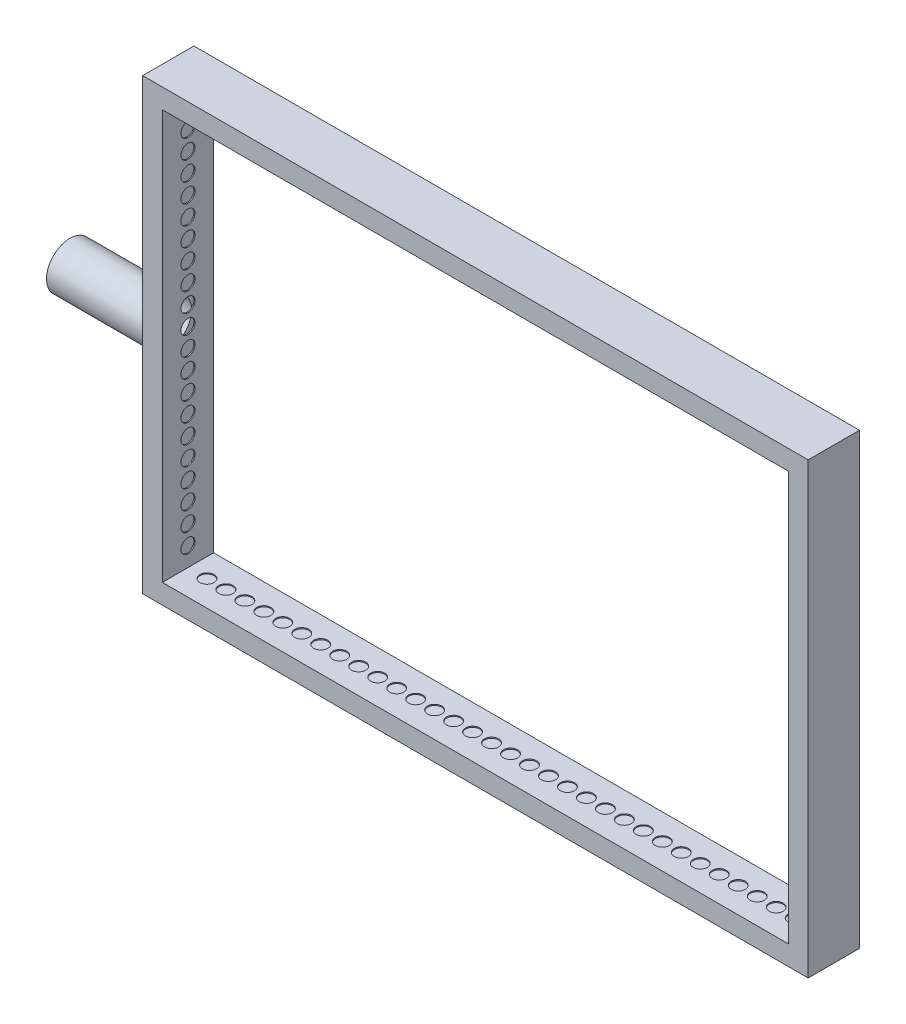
SolidWorks part; units mm, degrees
ref_plane "Alzado" through (0, 0, 0) normal (0, 0, 1) x (1, 0, 0)
ref_plane "Planta" through (0, 0, 0) normal (0, 1, 0) x (1, 0, 0)
ref_plane "Vista lateral" through (0, 0, 0) normal (1, 0, 0) x (0, 0, -1)
sketch "Croquis1" plane through (0, 0, 0) normal (0, 0, 1) x (1, 0, 0)
  line L1 (0, 0) -> (947, 0)
  line L2 (0, 0) -> (0, 638.5)
  line L3 (0, 638.5) -> (947, 638.5)
  line L4 (947, 0) -> (947, 638.5)
  line L10 (28, 610.5) -> (919, 610.5)
  line L11 (28, 610.5) -> (28, 28)
  line L12 (28, 28) -> (919, 28)
  line L13 (919, 610.5) -> (919, 28)
  dimension "D1" = 947
  dimension "D2" = 638.5
  dimension "D3" = 582.5
  dimension "D4" = 891
extrude "Saliente-Extruir1" add sketch "Croquis1" along normal blind 73
ref_plane "Plano1" through (0, 0, 36.5) normal (0, 0, 1) x (1, 0, 0)
sketch "Croquis2" plane through (0, 0, 36.5) normal (0, 0, 1) x (1, 0, 0)
  line L0 (945.5, 1.5) -> (945.5, 637)
  line L4 (920.5, 26.5) -> (26.5, 26.5)
  line L6 (920.5, 26.5) -> (920.5, 612)
  line L7 (1.5, 637) -> (945.5, 637)
  line L8 (1.5, 637) -> (1.5, 1.5)
  line L9 (1.5, 1.5) -> (945.5, 1.5)
  line L12 (920.5, 612) -> (26.5, 612)
  line L14 (26.5, 26.5) -> (26.5, 612)
extrude "Cortar-Extruir2" cut sketch "Croquis2" against normal mid plane 70
sketch "Croquis5" plane through (0, 28, 0) normal (0, 1, 0) x (1, 0, 0)
  line L0 (28, -73) -> (28, 0) construction
  circle A0 centre (55, -36.5) radius 10
  point P0 (28, -36.5)
  dimension "D1" = 27
  dimension "D2" = 20
extrude "Cortar-Extruir4" cut sketch "Croquis5" against normal blind 1.5
sketch "Croquis6" plane through (0, 28, 0) normal (0, 1, 0) x (1, 0, 0)
  circle A0 centre (82, -36.5) radius 10
  circle A1 centre (109, -36.5) radius 10
  circle A2 centre (136, -36.5) radius 10
  circle A3 centre (163, -36.5) radius 10
  circle A4 centre (190, -36.5) radius 10
  circle A5 centre (217, -36.5) radius 10
  circle A6 centre (244, -36.5) radius 10
  circle A7 centre (271, -36.5) radius 10
  circle A8 centre (298, -36.5) radius 10
  circle A9 centre (325, -36.5) radius 10
  circle A10 centre (352, -36.5) radius 10
  circle A11 centre (379, -36.5) radius 10
  circle A12 centre (406, -36.5) radius 10
  circle A13 centre (433, -36.5) radius 10
  circle A14 centre (460, -36.5) radius 10
  circle A15 centre (487, -36.5) radius 10
  circle A16 centre (514, -36.5) radius 10
  circle A17 centre (541, -36.5) radius 10
  circle A18 centre (568, -36.5) radius 10
  circle A19 centre (595, -36.5) radius 10
  circle A20 centre (622, -36.5) radius 10
  circle A21 centre (649, -36.5) radius 10
  circle A22 centre (676, -36.5) radius 10
  circle A23 centre (703, -36.5) radius 10
  circle A24 centre (730, -36.5) radius 10
  circle A25 centre (757, -36.5) radius 10
  circle A26 centre (784, -36.5) radius 10
  circle A27 centre (811, -36.5) radius 10
  circle A28 centre (838, -36.5) radius 10
  circle A29 centre (865, -36.5) radius 10
  circle A30 centre (892, -36.5) radius 10
  dimension "D1" = 31
extrude "Cortar-Extruir5" cut sketch "Croquis6" against normal blind 1.5
sketch "Croquis7" plane through (28, 0, 0) normal (1, 0, 0) x (0, 0, -1)
  line L0 (-73, 28) -> (0, 28) construction
  circle A0 centre (-36.5, 55) radius 10
  point P0 (-36.5, 28)
  dimension "D1" = 27
  dimension "D2" = 20
extrude "Cortar-Extruir6" cut sketch "Croquis7" against normal blind 1.5
sketch "Croquis8" plane through (28, 0, 0) normal (1, 0, 0) x (0, 0, -1)
  circle A0 centre (-36.5, 82) radius 10
  circle A1 centre (-36.5, 109) radius 10
  circle A2 centre (-36.5, 136) radius 10
  circle A3 centre (-36.5, 163) radius 10
  circle A4 centre (-36.5, 190) radius 10
  circle A5 centre (-36.5, 217) radius 10
  circle A6 centre (-36.5, 244) radius 10
  circle A7 centre (-36.5, 271) radius 10
  circle A8 centre (-36.5, 298) radius 10
  circle A9 centre (-36.5, 325) radius 10
  circle A10 centre (-36.5, 352) radius 10
  circle A11 centre (-36.5, 379) radius 10
  circle A12 centre (-36.5, 406) radius 10
  circle A13 centre (-36.5, 433) radius 10
  circle A14 centre (-36.5, 460) radius 10
  circle A15 centre (-36.5, 487) radius 10
  circle A16 centre (-36.5, 514) radius 10
  circle A17 centre (-36.5, 541) radius 10
  circle A18 centre (-36.5, 568) radius 10
  circle A19 centre (-36.5, 595) radius 10
  dimension "D1" = 20
  dimension "D2" = 20
extrude "Cortar-Extruir7" cut sketch "Croquis8" against normal blind 1.5
sketch "Croquis9" plane through (919, 0, 0) normal (-1, 0, 0) x (0, 0, 1)
  circle A0 centre (36.5, 55) radius 10
  circle A1 centre (36.5, 82) radius 10
  circle A2 centre (36.5, 109) radius 10
  circle A3 centre (36.5, 136) radius 10
  circle A4 centre (36.5, 163) radius 10
  circle A5 centre (36.5, 190) radius 10
  circle A6 centre (36.5, 217) radius 10
  circle A7 centre (36.5, 244) radius 10
  circle A8 centre (36.5, 271) radius 10
  circle A9 centre (36.5, 298) radius 10
  circle A10 centre (36.5, 325) radius 10
  circle A11 centre (36.5, 352) radius 10
  circle A12 centre (36.5, 379) radius 10
  circle A13 centre (36.5, 406) radius 10
  circle A14 centre (36.5, 433) radius 10
  circle A15 centre (36.5, 460) radius 10
  circle A16 centre (36.5, 487) radius 10
  circle A17 centre (36.5, 514) radius 10
  circle A18 centre (36.5, 541) radius 10
  circle A19 centre (36.5, 568) radius 10
  circle A20 centre (36.5, 595) radius 10
  dimension "D1" = 21
extrude "Cortar-Extruir8" cut sketch "Croquis9" against normal blind 1.5
sketch "Croquis10" plane through (0, 610.5, 0) normal (0, -1, 0) x (1, 0, 0)
  line L0 (919, 73) -> (919, 0) construction
  circle A0 centre (892, 36.5) radius 10
  circle A1 centre (865, 36.5) radius 10
  circle A2 centre (838, 36.5) radius 10
  circle A3 centre (811, 36.5) radius 10
  circle A4 centre (784, 36.5) radius 10
  circle A5 centre (757, 36.5) radius 10
  circle A6 centre (730, 36.5) radius 10
  circle A7 centre (703, 36.5) radius 10
  circle A8 centre (676, 36.5) radius 10
  circle A9 centre (649, 36.5) radius 10
  circle A10 centre (622, 36.5) radius 10
  circle A11 centre (595, 36.5) radius 10
  circle A12 centre (568, 36.5) radius 10
  circle A13 centre (541, 36.5) radius 10
  circle A14 centre (514, 36.5) radius 10
  circle A15 centre (487, 36.5) radius 10
  circle A16 centre (460, 36.5) radius 10
  circle A17 centre (433, 36.5) radius 10
  circle A18 centre (406, 36.5) radius 10
  circle A19 centre (379, 36.5) radius 10
  circle A20 centre (352, 36.5) radius 10
  circle A21 centre (325, 36.5) radius 10
  circle A22 centre (298, 36.5) radius 10
  circle A23 centre (271, 36.5) radius 10
  circle A24 centre (244, 36.5) radius 10
  circle A25 centre (217, 36.5) radius 10
  circle A26 centre (190, 36.5) radius 10
  circle A27 centre (163, 36.5) radius 10
  circle A28 centre (136, 36.5) radius 10
  circle A29 centre (109, 36.5) radius 10
  circle A30 centre (82, 36.5) radius 10
  circle A31 centre (55, 36.5) radius 10
  point P0 (919, 36.5)
  dimension "D1" = 27
  dimension "D2" = 20
  dimension "D3" = 32
extrude "Cortar-Extruir9" cut sketch "Croquis10" against normal blind 1.5
sketch "Croquis11" plane through (0, 0, 0) normal (-1, 0, 0) x (0, 0, 1)
  line L2 (36.5, -351.175) -> (36.5, 351.175) construction
  circle A0 centre (36.5, 316.5) radius 33.25
  dimension "D2" = 66.5
  dimension "D1" = 322
extrude "Saliente-Extruir2" add sketch "Croquis11" along normal blind 140
sketch "Croquis13" plane through (-140, 0, 0) normal (-1, 0, 0) x (0, 0, 1)
  circle A0 centre (36.5, 316.5) radius 31.75
  dimension "D1" = 63.5
extrude "Cortar-Extruir10" cut sketch "Croquis13" against normal up to next
sketch "Croquis14" plane through (0, 0, 0) normal (-1, 0, 0) x (0, 0, 1)
  line L1 (30.4429, 485.316) -> (40.738, 485.316)
  line L2 (30.4429, 485.316) -> (30.4429, 402.9552)
  line L3 (30.4429, 402.9552) -> (40.738, 402.9552)
  line L4 (40.738, 485.316) -> (40.738, 402.9552)
extrude "Saliente-Extruir3" add sketch "Croquis14" along normal blind 5
